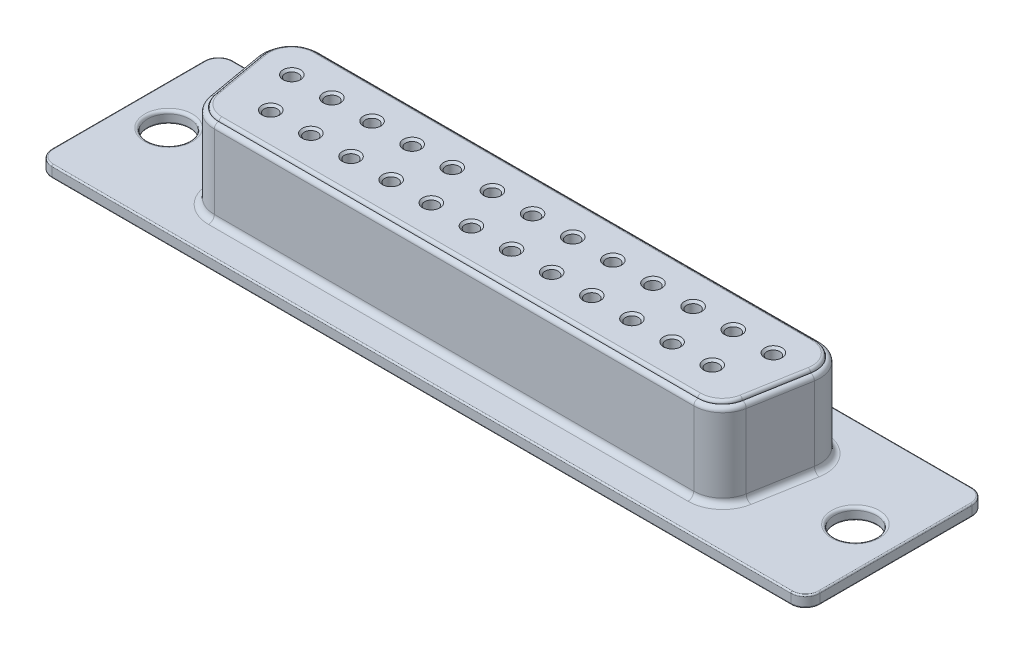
SolidWorks part; units mm, degrees
ref_plane "Front Plane" through (0, 0, 0) normal (0, 0, 1) x (1, 0, 0)
ref_plane "Top Plane" through (0, 0, 0) normal (0, 1, 0) x (1, 0, 0)
ref_plane "Right Plane" through (0, 0, 0) normal (1, 0, 0) x (0, 0, -1)
sketch "Sketch1" plane through (0, 0, 0) normal (0, 1, 0) x (1, 0, 0)
  line L0 (25.5, 5.25) -> (-25.5, -5.25) construction
  line L1 (25.5, -6.25) -> (-25.5, -6.25)
  line L2 (26.5, -5.25) -> (26.5, 5.25)
  line L3 (25.5, 6.25) -> (-25.5, 6.25)
  line L4 (-26.5, -5.25) -> (-26.5, 5.25)
  line L5 (-25.5, 5.25) -> (25.5, -5.25) construction
  arc A0 (-25.5, -6.25) -> (-26.5, -5.25) centre (-25.5, -5.25) cw
  arc A1 (25.5, -6.25) -> (26.5, -5.25) centre (25.5, -5.25) ccw
  arc A2 (26.5, 5.25) -> (25.5, 6.25) centre (25.5, 5.25) ccw
  arc A3 (-25.5, 6.25) -> (-26.5, 5.25) centre (-25.5, 5.25) ccw
  point P0 (0, 0)
  dimension "D1" = 1
  dimension "D2" = 53
  dimension "D3" = 12.5
extrude "Boss-Extrude1" add sketch "Sketch1" along normal blind 0.8
sketch "Sketch2" plane through (0, 0.8, 0) normal (0, 1, 0) x (1, 0, 0)
  line L1 (-23.7, 0) -> (23.7, 0) construction
  circle A0 centre (-23.7, 0) radius 1.45
  circle A1 centre (23.7, 0) radius 1.45
  point P0 (-23.7, 0)
  point P1 (23.7, 0)
  dimension "D3" = 2.9
  dimension "D1" = 47.4
extrude "Cut-Extrude1" cut sketch "Sketch2" against normal blind 0.8
sketch "Sketch3" plane through (0, 0.8, 0) normal (0, 1, 0) x (1, 0, 0)
  line L0 (-26.5, 0) -> (26.5, 0) construction
  line L1 (-17.2258, 3.7) -> (17.2258, 3.7)
  line L2 (-18.9, 1.7048) -> (-18.1947, -2.2952)
  line L3 (-16.5205, -3.7) -> (16.5205, -3.7)
  line L4 (18.9, 1.7048) -> (18.1947, -2.2952)
  line L5 (-26.5, 5.25) -> (-26.5, -5.25) construction
  line L6 (26.5, -5.25) -> (26.5, 5.25) construction
  line L7 (0, 6.25) -> (0, -6.25) construction
  line L8 (25.5, 6.25) -> (-25.5, 6.25) construction
  line L9 (-25.5, -6.25) -> (25.5, -6.25) construction
  line L10 (-11.08, 1.42) -> (-8.31, 1.42) construction
  line L11 (-8.31, 1.42) -> (-5.54, 1.42) construction
  line L12 (-5.54, 1.42) -> (-2.77, 1.42) construction
  line L13 (-2.77, 1.42) -> (0, 1.42) construction
  line L14 (0, 1.42) -> (2.77, 1.42) construction
  line L15 (2.77, 1.42) -> (5.54, 1.42) construction
  line L16 (5.54, 1.42) -> (8.31, 1.42) construction
  line L17 (8.31, 1.42) -> (11.08, 1.42) construction
  line L18 (9.7, -1.42) -> (6.93, -1.42) construction
  line L19 (6.93, -1.42) -> (4.16, -1.42) construction
  line L20 (4.16, -1.42) -> (1.39, -1.42) construction
  line L21 (1.39, -1.42) -> (-1.38, -1.42) construction
  line L22 (-1.38, -1.42) -> (-4.15, -1.42) construction
  line L23 (-4.15, -1.42) -> (-6.92, -1.42) construction
  line L24 (-6.92, -1.42) -> (-9.69, -1.42) construction
  line L25 (-11.08, 1.42) -> (-13.85, 1.42) construction
  line L26 (-13.85, 1.42) -> (-16.62, 1.42) construction
  line L27 (16.62, 1.42) -> (13.85, 1.42) construction
  line L28 (13.85, 1.42) -> (11.08, 1.42) construction
  line L29 (15.24, -1.42) -> (12.47, -1.42) construction
  line L30 (12.47, -1.42) -> (9.7, -1.42) construction
  line L31 (-9.69, -1.42) -> (-12.46, -1.42) construction
  line L32 (-12.46, -1.42) -> (-15.23, -1.42) construction
  arc A0 (17.2258, 3.7) -> (18.9, 1.7048) centre (17.2258, 2) cw
  circle A1 centre (-5.54, 1.42) radius 0.45
  circle A2 centre (-2.77, 1.42) radius 0.45
  circle A3 centre (0, 1.42) radius 0.45
  circle A4 centre (2.77, 1.42) radius 0.45
  circle A5 centre (5.54, 1.42) radius 0.45
  circle A6 centre (-4.15, -1.42) radius 0.45
  circle A7 centre (-1.38, -1.42) radius 0.45
  circle A8 centre (1.39, -1.42) radius 0.45
  circle A9 centre (4.16, -1.42) radius 0.45
  arc A10 (16.5205, -3.7) -> (18.1947, -2.2952) centre (16.5205, -2) ccw
  arc A11 (-18.1947, -2.2952) -> (-16.5205, -3.7) centre (-16.5205, -2) ccw
  arc A12 (-17.2258, 3.7) -> (-18.9, 1.7048) centre (-17.2258, 2) ccw
  circle A13 centre (-8.31, 1.42) radius 0.45
  circle A14 centre (-11.08, 1.42) radius 0.45
  circle A15 centre (8.31, 1.42) radius 0.45
  circle A16 centre (11.08, 1.42) radius 0.45
  circle A17 centre (-9.69, -1.42) radius 0.45
  circle A18 centre (-6.92, -1.42) radius 0.45
  circle A19 centre (6.93, -1.42) radius 0.45
  circle A20 centre (9.7, -1.42) radius 0.45
  circle A21 centre (-13.85, 1.42) radius 0.45
  circle A22 centre (-16.62, 1.42) radius 0.45
  circle A23 centre (-12.46, -1.42) radius 0.45
  circle A24 centre (-15.23, -1.42) radius 0.45
  circle A25 centre (12.47, -1.42) radius 0.45
  circle A26 centre (15.24, -1.42) radius 0.45
  circle A27 centre (13.85, 1.42) radius 0.45
  circle A28 centre (16.62, 1.42) radius 0.45
  point P0 (0, 0)
  dimension "D7" = 2.84
  dimension "D13" = 80
  dimension "D3" = 1.7
  dimension "D14" = 0.9
  dimension "D2" = 7.4
  dimension "D4" = 37.8
  dimension "D5" = 2.77
  dimension "D6" = 1.39
  dimension "D8" = 1.42
extrude "Boss-Extrude2" add sketch "Sketch3" along normal blind 6
sketch "Sketch12" plane through (0, 0.8, 0) normal (0, 1, 0) x (1, 0, 0)
  line L0 (-19.2196, 1.6527) -> (-18.5143, -2.3473)
  line L1 (-16.5447, -4) -> (16.5447, -4)
  line L2 (18.5143, -2.3473) -> (19.2196, 1.6527)
  line L3 (17.25, 4) -> (-17.25, 4)
  line L4 (-26.5, 0) -> (26.5, 0) construction
  line L5 (-26.5, 5.25) -> (-26.5, -5.25) construction
  line L6 (26.5, -5.25) -> (26.5, 5.25) construction
  line L7 (0, 6.25) -> (0, -6.25) construction
  line L8 (25.5, 6.25) -> (-25.5, 6.25) construction
  line L9 (-25.5, -6.25) -> (25.5, -6.25) construction
  arc A0 (19.2196, 1.6527) -> (17.25, 4) centre (17.25, 2) ccw
  arc A1 (-17.25, 4) -> (-19.2196, 1.6527) centre (-17.25, 2) ccw
  arc A2 (16.5447, -4) -> (18.5143, -2.3473) centre (16.5447, -2) ccw
  arc A3 (-18.5143, -2.3473) -> (-16.5447, -4) centre (-16.5447, -2) ccw
  point P0 (0, 0)
  dimension "D1" = 2
  dimension "D2" = 2
  dimension "D5" = 38.5
  dimension "D3" = 8
  dimension "D4" = 80
extrude "Boss-Extrude4" add sketch "Sketch12" along normal blind 5.8 separate body
shell "Shell1" thickness 0.3
sketch "Sketch13" plane through (0, 1.1, 0) normal (0, 1, 0) x (1, 0, 0)
  line L0 (0, 2.745) -> (0, 3.445) construction
  line L7 (-2.77, 3.445) -> (-2.77, 2.745) construction
  line L14 (-5.54, 2.745) -> (-5.54, 3.445) construction
  line L16 (2.77, 2.745) -> (2.77, 3.445) construction
  line L18 (5.54, 3.445) -> (5.54, 2.745) construction
  line L21 (-1.385, -2.745) -> (-1.385, -3.445) construction
  line L23 (-4.155, -3.445) -> (-4.155, -2.745) construction
  line L25 (1.385, -3.445) -> (1.385, -2.745) construction
  line L27 (4.155, -2.745) -> (4.155, -3.445) construction
  text T0 "1" font "Arial" height 0.7
  text T1 "2" font "Arial" height 0.7
  text T2 "3" font "Arial" height 0.7
  text T3 "4" font "Arial" height 0.7
  text T4 "5" font "Arial" height 0.7
  text T5 "6" font "Arial" height 0.7
  text T6 "7" font "Arial" height 0.7
  text T7 "8" font "Arial" height 0.7
  text T8 "9" font "Arial" height 0.7
  point P0 (0, 3.095)
  point P1 (0, 3.095)
  point P10 (0, -3.095)
extrude "Boss-Extrude5" add sketch "Sketch13" along normal blind 0.1
fillet "Fillet9" radius 0.3 8 edges at (-18.7821, 6.6, -3.2856) (0, 6.6, -4) (18.7821, 6.6, -3.2856) (18.867, 6.6, 0.3473) (17.8303, 6.6, 3.5321) (0, 6.6, 4) (-17.8303, 6.6, 3.5321) (-18.867, 6.6, 0.3473)
fillet "Fillet10" radius 0.4 8 edges at (-17.8303, 0.8, 3.5321) (-18.867, 0.8, 0.3473) (-18.7821, 0.8, -3.2856) (0, 0.8, -4) (18.7821, 0.8, -3.2856) (18.867, 0.8, 0.3473) (17.8303, 0.8, 3.5321) (0, 0.8, 4)
fillet "Fillet14" radius 0.2 2 edges at (23.7, 0.8, 1.45) (-23.7, 0.8, 1.45)
fillet "Fillet15" radius 0.1 18 edges at (0, 0, 6.25) (26.2071, 0, 5.9571) (26.5, 0, 0) (26.2071, 0, -5.9571) (0, 0, -6.25) (-26.2071, 0, -5.9571) (-26.5, 0, 0) (-26.2071, 0, 5.9571) (-26.5, 0.8, 0) (-26.2071, 0.8, -5.9571) (0, 0.8, -6.25) (26.2071, 0.8, -5.9571) (26.5, 0.8, 0) (26.2071, 0.8, 5.9571) (0, 0.8, 6.25) (-26.2071, 0.8, 5.9571) (-23.7, 0, 1.45) (23.7, 0, 1.45)
sketch "Sketch16" plane through (0, 0, 0) normal (0, -1, 0) x (1, 0, 0)
  line L0 (-20.6196, -3.0527) -> (-19.4206, 3.7473)
  line L1 (18.65, -5.4) -> (-18.65, -5.4)
  line L2 (0, -5.4) -> (0, 5.4) construction
  line L3 (17.451, 5.4) -> (-17.451, 5.4)
  line L5 (19.4206, 3.7473) -> (20.6196, -3.0527)
  arc A0 (19.4206, 3.7473) -> (17.451, 5.4) centre (17.451, 3.4) ccw
  arc A1 (-19.4206, 3.7473) -> (-17.451, 5.4) centre (-17.451, 3.4) cw
  arc A2 (18.65, -5.4) -> (20.6196, -3.0527) centre (18.65, -3.4) ccw
  arc A3 (-18.65, -5.4) -> (-20.6196, -3.0527) centre (-18.65, -3.4) cw
  point P0 (0, 0)
  dimension "D1" = 2
  dimension "D2" = 41.3
  dimension "D3" = 20
  dimension "D4" = 10.8
sketch "Sketch14" plane through (0, 1.1, 0) normal (0, 1, 0) x (1, 0, 0)
  circle A0 centre (-16.62, 1.42) radius 0.57
  circle A1 centre (-5.54, 1.42) radius 0.57
  circle A2 centre (-13.85, 1.42) radius 0.57
  circle A3 centre (-2.77, 1.42) radius 0.57
  circle A4 centre (-15.23, -1.42) radius 0.57
  circle A5 centre (0, 1.42) radius 0.57
  circle A6 centre (-12.46, -1.42) radius 0.57
  circle A7 centre (2.77, 1.42) radius 0.57
  circle A8 centre (13.85, 1.42) radius 0.57
  circle A9 centre (5.54, 1.42) radius 0.57
  circle A10 centre (16.62, 1.42) radius 0.57
  circle A11 centre (-4.15, -1.42) radius 0.57
  circle A12 centre (15.24, -1.42) radius 0.57
  circle A13 centre (-1.38, -1.42) radius 0.57
  circle A14 centre (12.47, -1.42) radius 0.57
  circle A15 centre (1.39, -1.42) radius 0.57
  circle A17 centre (4.16, -1.42) radius 0.57
  circle A78 centre (-11.08, 1.42) radius 0.57
  circle A79 centre (-8.31, 1.42) radius 0.57
  circle A80 centre (-9.69, -1.42) radius 0.57
  circle A81 centre (-6.92, -1.42) radius 0.57
  circle A82 centre (8.31, 1.42) radius 0.57
  circle A83 centre (11.08, 1.42) radius 0.57
  circle A84 centre (9.7, -1.42) radius 0.57
  circle A85 centre (6.93, -1.42) radius 0.57
  dimension "D1" = 1.14
fillet "Fillet30" radius 0.2 8 edges at (18.5281, 6.8, -3.0927) (18.5473, 6.8, 0.2952) (17.6133, 6.8, 3.3023) (0, 6.8, 3.7) (-17.6133, 6.8, 3.3023) (-18.5473, 6.8, 0.2952) (-18.5281, 6.8, -3.0927) (0, 6.8, -3.7)
chamfer "Chamfer1" distance 0.15 angle 45 25 edges at (11.08, 6.8, -0.97) (9.7, 6.8, 1.87) (6.93, 6.8, 1.87) (8.31, 6.8, -0.97) (5.54, 6.8, -0.97) (4.16, 6.8, 1.87) (1.39, 6.8, 1.87) (2.77, 6.8, -0.97) (0, 6.8, -0.97) (-2.77, 6.8, -0.97) (-1.38, 6.8, 1.87) (-4.15, 6.8, 1.87) (-5.54, 6.8, -0.97) (-6.92, 6.8, 1.87) (-9.69, 6.8, 1.87) (-8.31, 6.8, -0.97) (-11.08, 6.8, -0.97) (12.47, 6.8, 1.87) (15.24, 6.8, 1.87) (16.62, 6.8, -0.97) (13.85, 6.8, -0.97) (-12.46, 6.8, 1.87) (-15.23, 6.8, 1.87) (-13.85, 6.8, -0.97) (-16.62, 6.8, -0.97)
sketch "Cut Out" plane through (0, 0.8, 0) normal (0, 1, 0) x (1, 0, 0)
  line L0 (-20.9483, 1.7096) -> (-20.1372, -2.8904)
  line L1 (-16.7889, -5.7) -> (16.7889, -5.7)
  line L2 (20.1372, -2.8904) -> (20.9483, 1.7096)
  line L3 (17.6, 5.7) -> (-17.6, 5.7)
  line L4 (0, 5.7) -> (0, -5.7) construction
  circle A0 centre (-23.7, 0) radius 1.5
  circle A1 centre (23.7, 0) radius 1.5
  arc A2 (-20.1372, -2.8904) -> (-16.7889, -5.7) centre (-16.7889, -2.3) ccw
  arc A3 (16.7889, -5.7) -> (20.1372, -2.8904) centre (16.7889, -2.3) ccw
  arc A4 (20.9483, 1.7096) -> (17.6, 5.7) centre (17.6, 2.3) ccw
  arc A5 (-17.6, 5.7) -> (-20.9483, 1.7096) centre (-17.6, 2.3) ccw
  dimension "D2" = 3
  dimension "D5" = 3.4
  dimension "D6" = 42
  dimension "D1" = 20
  dimension "D3" = 11.4
  dimension "D4" = 5.7
sketch "Cut Space" plane through (0, 0.8, 0) normal (0, 1, 0) x (1, 0, 0)
  line L1 (-26.1, -7.7) -> (26.1, -7.7)
  line L2 (-28.1, -5.7) -> (-28.1, 5.7)
  line L3 (-26.1, 7.7) -> (26.1, 7.7)
  line L4 (28.1, -5.7) -> (28.1, 5.7)
  line L5 (-28.1, -7.7) -> (28.1, 7.7) construction
  line L6 (-28.1, 7.7) -> (28.1, -7.7) construction
  line L7 (26.5, 5.25) -> (26.5, -5.25) construction
  arc A0 (26.1, 7.7) -> (28.1, 5.7) centre (26.1, 5.7) cw
  arc A1 (28.1, -5.7) -> (26.1, -7.7) centre (26.1, -5.7) cw
  arc A2 (-26.1, -7.7) -> (-28.1, -5.7) centre (-26.1, -5.7) cw
  arc A3 (-28.1, 5.7) -> (-26.1, 7.7) centre (-26.1, 5.7) cw
  point P0 (0, 0)
  dimension "D3" = 2
  dimension "D1" = 1.6
  dimension "D2" = 15.4
